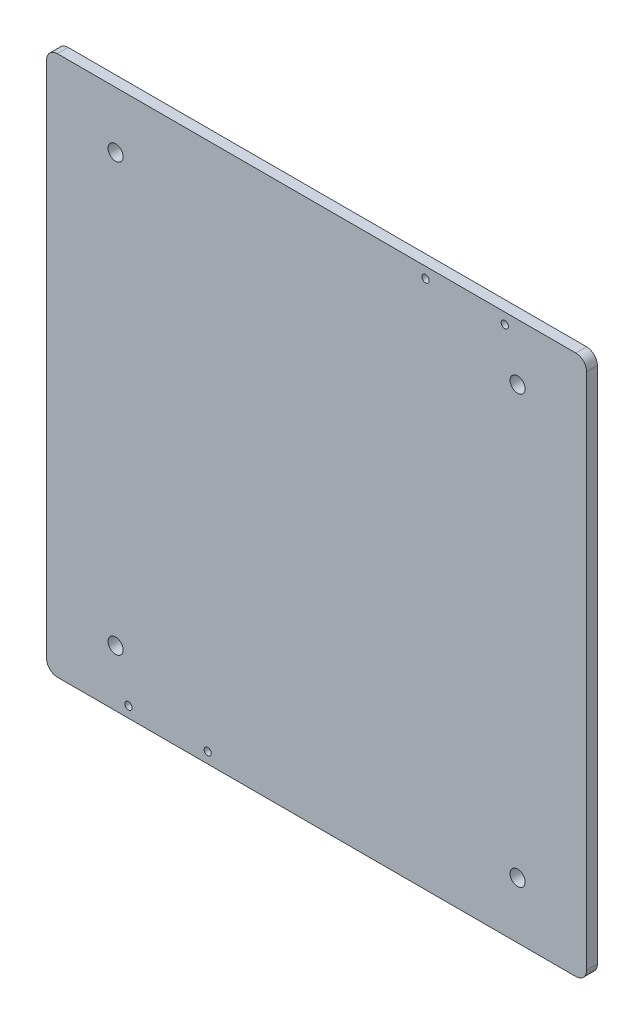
SolidWorks part; units mm, degrees
ref_plane "Front Plane" through (0, 0, 0) normal (0, 0, 1) x (1, 0, 0)
ref_plane "Top Plane" through (0, 0, 0) normal (0, 1, 0) x (1, 0, 0)
ref_plane "Right Plane" through (0, 0, 0) normal (1, 0, 0) x (0, 0, -1)
sketch "Sketch1" plane through (0, 0, 0) normal (0, 0, 1) x (1, 0, 0)
  line L1 (-75, -75) -> (75, -75)
  line L2 (-75, -75) -> (-75, 75)
  line L3 (-75, 75) -> (75, 75)
  line L4 (75, -75) -> (75, 75)
  line L5 (-75, -75) -> (75, 75) construction
  line L6 (-75, 75) -> (75, -75) construction
  point P0 (0, 0)
  dimension "D1" = 150
  dimension "D2" = 150
extrude "Boss-Extrude1" add sketch "Sketch1" along normal blind 3
fillet "Fillet1" radius 3 4 edges at (75, -75, 1.5) (-75, -75, 1.5) (-75, 75, 1.5) (75, 75, 1.5)
sketch "Sketch2" plane through (0, 0, 0) normal (0, 0, -1) x (-1, 0, 0)
  line L1 (-55.835, -59.325) -> (55.835, -59.325) construction
  line L2 (-55.835, -59.325) -> (-55.835, 59.325) construction
  line L3 (-55.835, 59.325) -> (55.835, 59.325) construction
  line L4 (55.835, -59.325) -> (55.835, 59.325) construction
  line L5 (-55.835, -59.325) -> (55.835, 59.325) construction
  line L6 (-55.835, 59.325) -> (55.835, -59.325) construction
  circle A0 centre (-55.835, 59.325) radius 2.1
  circle A1 centre (55.835, 59.325) radius 2.1
  circle A2 centre (-55.835, -59.325) radius 2.1
  circle A3 centre (55.835, -59.325) radius 2.1
  point P0 (0, 0)
  dimension "D1" = 118.65
  dimension "D2" = 111.67
extrude "Cut-Extrude1" cut sketch "Sketch2" against normal up to surface (3 mm away)
sketch "Sketch3" plane through (0, 0, 0) normal (0, 0, -1) x (-1, 0, 0)
  line L0 (-75, 72) -> (75, 72) construction
  line L1 (-75, -72) -> (-75, 72) construction
  line L2 (75, 72) -> (75, -72) construction
  line L3 (-72, 75) -> (72, 75) construction
  line L4 (-75, -72) -> (75, -72) construction
  line L5 (72, -75) -> (-72, -75) construction
  circle A0 centre (-52.26, 72) radius 1
  circle A1 centre (-30.26, 72) radius 1
  circle A2 centre (52.26, -72) radius 1
  circle A3 centre (30.26, -72) radius 1
  dimension "D2" = 2
  dimension "D4" = 22
  dimension "D5" = 2
  dimension "D7" = 2
  dimension "D9" = 2
  dimension "D1" = 3
  dimension "D3" = 22.74
  dimension "D6" = 3
  dimension "D8" = 22.74
  dimension "D10" = 22
extrude "Cut-Extrude2" cut sketch "Sketch3" against normal up to surface (3 mm away)
